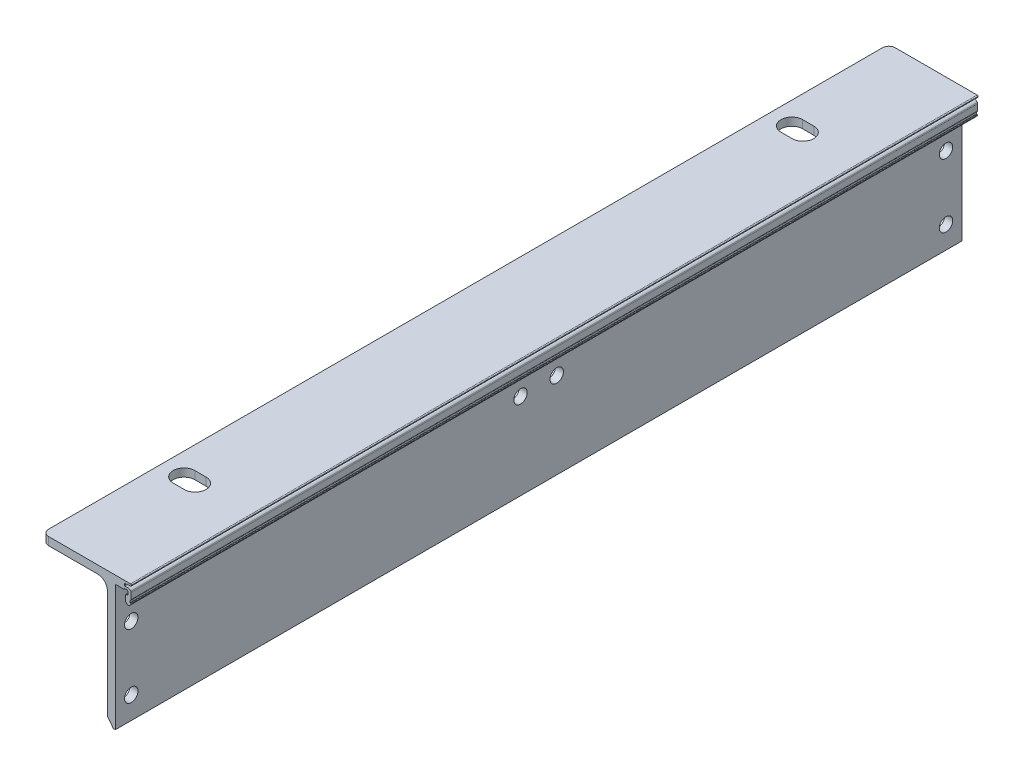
SolidWorks part; units mm, degrees
ref_plane "前视基准面" through (0, 0, 0) normal (0, 0, 1) x (1, 0, 0)
ref_plane "上视基准面" through (0, 0, 0) normal (0, 1, 0) x (1, 0, 0)
ref_plane "右视基准面" through (0, 0, 0) normal (1, 0, 0) x (0, 0, -1)
sketch "草图1" plane through (0, 0, 0) normal (0, 0, 1) x (1, 0, 0)
  line L0 (2329.984, -3290.1038) -> (2355.384, -3290.1038)
  line L1 (2329.984, -3292.6038) -> (2350.384, -3292.6038)
  line L2 (2352.884, -3292.6038) -> (2355.384, -3292.6038)
  line L3 (2350.384, -3292.6038) -> (2350.384, -3329.6038)
  line L4 (2352.884, -3292.6038) -> (2352.884, -3332.1038)
  line L5 (2355.384, -3292.6038) -> (2355.384, -3290.1038) construction
  line L6 (2355.384, -3290.1038) -> (2357.924, -3290.1038) construction
  line L8 (2329.984, -3290.1038) -> (2329.984, -3292.6038)
  line L10 (2352.884, -3332.1038) -> (2352.284, -3332.1038)
  line L11 (2350.384, -3329.6038) -> (2352.284, -3332.1038)
  line L12 (2356.524, -3292.3038) -> (2355.988, -3292.3038)
  line L13 (2357.5972, -3295.408) -> (2357.724, -3295.408)
  line L14 (2357.624, -3290.1038) -> (2357.924, -3290.1038) construction
  line L15 (2357.8006, -3295.5917) -> (2357.3831, -3296.0891)
  line L16 (2357.4972, -3294.808) -> (2357.4972, -3295.308)
  line L17 (2357.824, -3295.508) -> (2357.824, -3295.5274)
  line L18 (2357.824, -3292.376) -> (2357.824, -3294.2738)
  line L19 (2356.324, -3293.7038) -> (2356.524, -3293.7038)
  line L20 (2356.024, -3295.4545) -> (2356.024, -3294.0038)
  line L21 (2357.7449, -3290.6914) -> (2355.9031, -3290.8849)
  line L22 (2355.724, -3291.0839) -> (2355.724, -3291.4038)
  line L23 (2355.924, -3291.6038) -> (2356.77, -3291.6038)
  line L24 (2357.924, -3290.4038) -> (2357.924, -3290.4925)
  line L25 (2356.465, -3296.0891) -> (2356.0943, -3295.6474)
  line L26 (2356.824, -3293.4038) -> (2356.824, -3292.6038)
  line L27 (2357.924, -3290.4038) -> (2357.924, -3290.1038) construction
  line L28 (2355.384, -3292.6038) -> (2355.4683, -3292.6038)
  line L29 (2355.384, -3290.1038) -> (2357.624, -3290.1038)
  arc A0 (2357.4972, -3294.808) -> (2357.6606, -3294.5409) centre (2357.7972, -3294.808) cw
  arc A1 (2356.77, -3291.6038) -> (2357.7198, -3292.0704) centre (2356.77, -3292.8038) cw
  arc A2 (2357.824, -3295.5274) -> (2357.8006, -3295.5917) centre (2357.724, -3295.5274) cw
  arc A3 (2355.724, -3291.0839) -> (2355.9031, -3290.8849) centre (2355.924, -3291.0839) cw
  arc A4 (2357.924, -3290.4925) -> (2357.7449, -3290.6914) centre (2357.724, -3290.4925) cw
  arc A5 (2355.7282, -3292.4538) -> (2355.4683, -3292.6038) centre (2355.4683, -3292.3038) cw
  arc A6 (2357.624, -3290.1038) -> (2357.924, -3290.4038) centre (2357.624, -3290.4038) cw
  arc A7 (2357.5972, -3295.408) -> (2357.4972, -3295.308) centre (2357.5972, -3295.308) cw
  arc A8 (2357.824, -3294.2738) -> (2357.6606, -3294.5409) centre (2357.524, -3294.2738) cw
  arc A9 (2355.924, -3291.6038) -> (2355.724, -3291.4038) centre (2355.924, -3291.4038) cw
  arc A10 (2356.524, -3292.3038) -> (2356.824, -3292.6038) centre (2356.524, -3292.6038) cw
  arc A11 (2356.0943, -3295.6474) -> (2356.024, -3295.4545) centre (2356.324, -3295.4545) cw
  arc A12 (2355.7282, -3292.4538) -> (2355.988, -3292.3038) centre (2355.988, -3292.6038) cw
  arc A13 (2357.7198, -3292.0704) -> (2357.824, -3292.376) centre (2357.324, -3292.376) cw
  arc A14 (2356.024, -3294.0038) -> (2356.324, -3293.7038) centre (2356.324, -3294.0038) cw
  arc A15 (2356.824, -3293.4038) -> (2356.524, -3293.7038) centre (2356.524, -3293.4038) cw
  arc A16 (2357.3831, -3296.0891) -> (2356.465, -3296.0891) centre (2356.924, -3295.7038) cw
  arc A17 (2357.724, -3295.408) -> (2357.824, -3295.508) centre (2357.724, -3295.508) cw
  dimension "D1" = 39.5
  dimension "D2" = 0.6
  dimension "D3" = 2.5
  dimension "D4" = 20.4
  dimension "D5" = 127.235
extrude "凸台-拉伸1" add sketch "草图1" along normal mid plane 265.35
fillet "圆角2" radius 3 1 edges at (2350.384, -3292.6038, 0)
sketch "草图2" plane through (0, -3290.1038, 0) normal (0, 1, 0) x (1, 0, 0)
  line L0 (2338.734, 98.65) -> (2338.734, 91.85) construction
  line L3 (2370.3278, 0) -> (2329.984, 0) construction
  line L5 (2329.984, -132.675) -> (2329.984, 132.675) construction
  line L6 (2340.484, -91.85) -> (2336.984, -91.85)
  line L7 (2340.484, -98.65) -> (2336.984, -98.65)
  line L9 (2340.484, 98.65) -> (2336.984, 98.65)
  line L10 (2340.484, 91.85) -> (2336.984, 91.85)
  arc A0 (2336.984, -98.65) -> (2336.984, -91.85) centre (2336.984, -95.25) cw
  arc A1 (2336.984, 98.65) -> (2336.984, 91.85) centre (2336.984, 95.25) ccw
  arc A2 (2340.484, -91.85) -> (2340.484, -98.65) centre (2340.484, -95.25) cw
  arc A4 (2340.484, 91.85) -> (2340.484, 98.65) centre (2340.484, 95.25) ccw
  dimension "D4" = 8.75
  dimension "D1" = 190.5
  dimension "D5" = 3.5
  dimension "D6" = 3.4
extrude "切除-拉伸1" cut sketch "草图2" against normal through all
sketch "草图3" plane through (2350.384, 0, 0) normal (-1, 0, 0) x (0, 0, 1)
  line L0 (-132.675, -3295.6038) -> (-132.675, -3329.6038) construction
  line L1 (132.675, -3290.1038) -> (-132.675, -3290.1038) construction
  line L2 (0, -3290.1038) -> (0, -3332.1038) construction
  line L3 (132.675, -3332.1038) -> (-132.675, -3332.1038) construction
  circle A0 centre (-127.675, -3305.1038) radius 2.1
  circle A2 centre (-127.675, -3325.1038) radius 2.1
  circle A3 centre (5.675, -3305.1038) radius 2.1
  circle A4 centre (-5.675, -3305.1038) radius 2.1
  circle A5 centre (127.675, -3305.1038) radius 2.1
  circle A7 centre (127.675, -3325.1038) radius 2.1
  dimension "D1" = 4.2
  dimension "D2" = 5
  dimension "D3" = 15
  dimension "D5" = 2
  dimension "D7" = 5.675
  dimension "D8" = 5.675
  dimension "D9" = 11.35
  dimension "D4" = 20
  dimension "D6" = 4.2
  dimension "D10" = 20
  dimension "D11" = 4.2
  dimension "D12" = 4.2
extrude "切除-拉伸2" cut sketch "草图3" against normal through all
fillet "圆角1" radius 2 2 edges at (2329.984, -3291.3538, -132.675) (2329.984, -3291.3538, 132.675)
